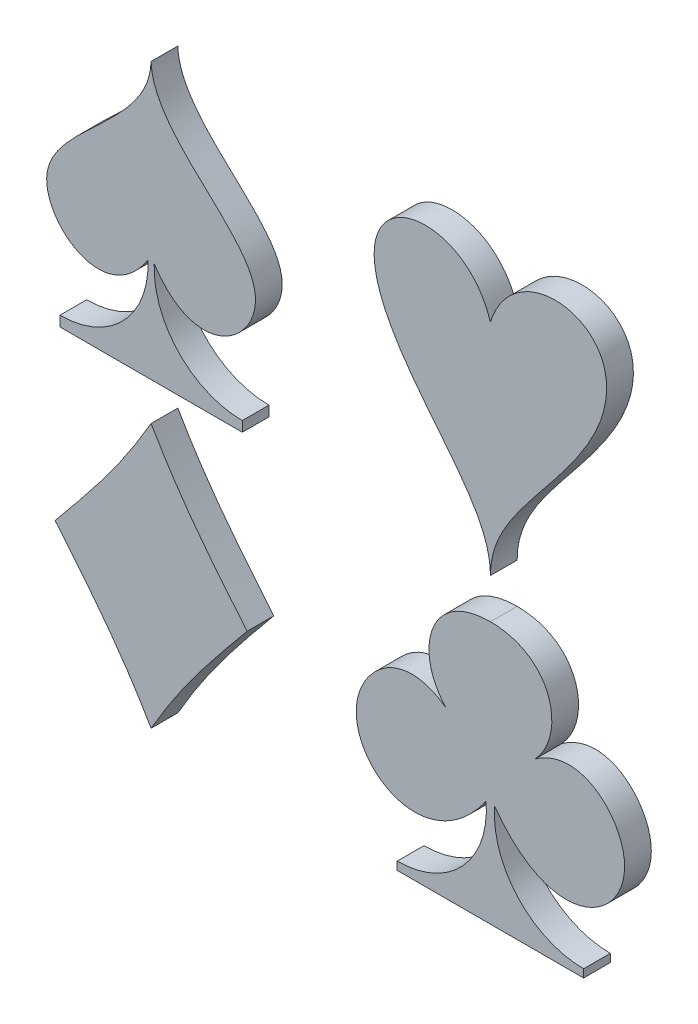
SolidWorks part; units mm, degrees
ref_plane "Front Plane" through (0, 0, 0) normal (0, 0, 1) x (1, 0, 0)
ref_plane "Top Plane" through (0, 0, 0) normal (0, 1, 0) x (1, 0, 0)
ref_plane "Right Plane" through (0, 0, 0) normal (1, 0, 0) x (0, 0, -1)
sketch "Picture" plane through (0, 0, 0) normal (0, 0, 1) x (1, 0, 0)
  line L0 (-68.5134, -8.4865) -> (-68.5134, -108.4865) construction
  dimension "D1" = 100
sketch "Sketch3" plane through (0, 0, 0) normal (0, 0, 1) x (1, 0, 0)
  line L0 (-68.5775, 108.7145) -> (-68.5775, 5.5592) construction
  line L1 (-68.5775, -8.6691) -> (-68.5775, -107.4768) construction
  line L2 (58.4536, 87.7673) -> (58.4536, 5.5592) construction
  line L3 (58.4536, -9.4414) -> (58.4536, -107.4768) construction
  line L4 (-34.4253, 5.5592) -> (-102.7297, 5.5592)
  line L5 (-102.7297, 5.5592) -> (-102.7297, 9.358)
  line L6 (58.4536, 87.7673) -> (44.11, 133.0691) construction
  line L7 (44.11, 133.0691) -> (-31.3178, 100.1776) construction
  line L8 (-31.3178, 100.1776) -> (21.6053, 56.1575) construction
  line L9 (58.4536, 35.384) -> (58.4536, 5.5592) construction
  line L10 (21.6053, 56.1575) -> (58.4536, 35.384) construction
  line L11 (58.4536, 87.7673) -> (72.7973, 133.0691) construction
  line L12 (72.7973, 133.0691) -> (148.225, 100.1776) construction
  line L13 (148.225, 100.1776) -> (95.3019, 56.1575) construction
  line L14 (95.3019, 56.1575) -> (58.4536, 35.384) construction
  line L15 (58.4536, 35.384) -> (58.4536, 5.5592) construction
  line L16 (-34.4253, 5.5592) -> (-34.4253, 9.358)
  line L17 (-104.5067, -58.073) -> (-31.3178, -58.073) construction
  line L18 (93.3438, -107.4768) -> (23.5635, -107.4768)
  line L19 (23.5635, -107.4768) -> (23.5635, -104.4784)
  line L20 (70.2047, -9.4414) -> (46.7026, -9.4414) construction
  line L21 (93.3438, -107.4768) -> (93.3438, -104.4784)
  arc A0 (-102.7297, 9.358) -> (-69.7446, 43.6985) centre (-102.7297, 42.3699) ccw
  arc A1 (-34.4253, 9.358) -> (-67.4104, 43.6985) centre (-34.4253, 42.3699) cw
  arc A2 (23.5635, -104.4784) -> (56.8446, -68.4457) centre (23.5635, -71.0923) ccw
  arc A3 (93.3438, -104.4784) -> (60.0627, -68.4457) centre (93.3438, -71.0923) cw
  spline S0 degree 3 poles (-69.7446, 43.6985) (-85.9651, 19.1359) (-136.5743, 58.0526) (-69.2554, 85.9552) (-68.5775, 108.7145) knots 0 0 0 0 0.458371 1 1 1 1
  spline_without_curve S1
  spline_without_curve S2
  spline S3 degree 3 poles (-67.4104, 43.6985) (-51.1899, 19.1359) (-0.5807, 58.0526) (-67.8996, 85.9552) (-68.5775, 108.7145) knots 0 0 0 0 0.458371 1 1 1 1
  spline S4 degree 3 poles (-68.5775, -8.6691) (-80.0377, -28.4922) (-90.4481, -41.0274) (-104.5067, -58.073) knots 0 0 0 0 1 1 1 1
  spline S5 degree 3 poles (-68.5775, -8.6691) (-57.1173, -28.4922) (-46.7069, -41.0274) (-32.6484, -58.073) knots 0 0 0 0 1 1 1 1
  spline S6 degree 3 poles (-68.5775, -107.4768) (-80.0377, -87.6537) (-90.4481, -75.1185) (-104.5067, -58.073) knots 0 0 0 0 1 1 1 1
  spline S7 degree 3 poles (-68.5775, -107.4768) (-57.1173, -87.6537) (-46.7069, -75.1185) (-32.6484, -58.073) knots 0 0 0 0 1 1 1 1
  spline S8 degree 3 poles (56.8446, -68.4457) (33.8719, -100.4228) (-12.9735, -68.7906) (25.4089, -33.9829) (41.7, -45.5361) knots 0 0 0 0 0.620625 1 1 1 1
  spline S9 degree 3 poles (41.7, -45.5361) (29.447, -32.1707) (35.3412, -9.4414) (58.4536, -9.4414) knots 0 0 0 0 1 1 1 1
  spline S10 degree 3 poles (75.2072, -45.5361) (87.4603, -32.1707) (81.5661, -9.4414) (58.4536, -9.4414) knots 0 0 0 0 1 1 1 1
  spline S11 degree 3 poles (60.0627, -68.4457) (83.0353, -100.4228) (129.8808, -68.7906) (91.4984, -33.9829) (75.2072, -45.5361) knots 0 0 0 0 0.620625 1 1 1 1
extrude "Boss-Extrude1" add sketch "Sketch3" along normal blind 10
